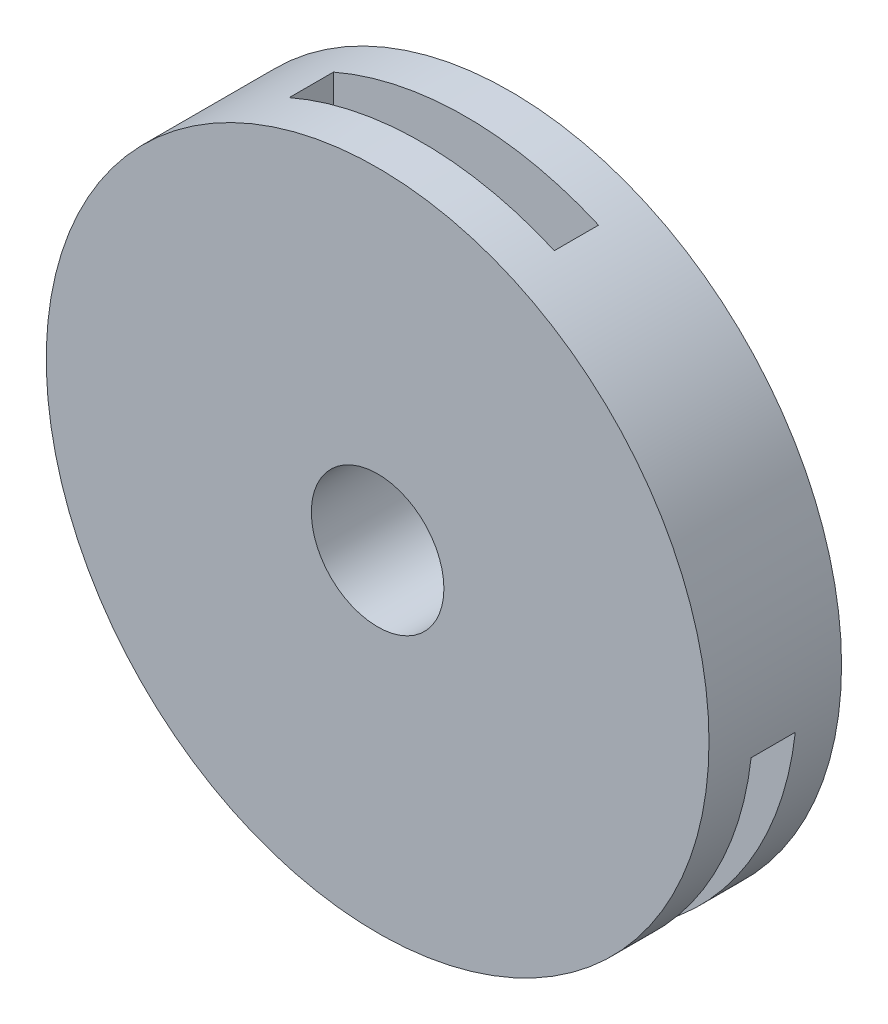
SolidWorks part; units mm, degrees
ref_plane "Alzado" through (0, 0, 0) normal (0, 0, 1) x (1, 0, 0)
ref_plane "Planta" through (0, 0, 0) normal (0, 1, 0) x (1, 0, 0)
ref_plane "Vista lateral" through (0, 0, 0) normal (1, 0, 0) x (0, 0, -1)
sketch "Croquis1" plane through (0, 0, 0) normal (0, 0, 1) x (1, 0, 0)
  circle A0 centre (0, 0) radius 75
  dimension "D1" = 150
extrude "Saliente-Extruir1" add sketch "Croquis1" along normal blind 30
ref_plane "Plano1" through (0, 40, 0) normal (0, 1, 0) x (-1, 0, 0)
sketch "Croquis5" plane through (0, 40, 0) normal (0, 1, 0) x (-1, 0, 0)
  line L1 (0, 10) -> (30, 10)
  line L2 (30, 10) -> (30, 20)
  line L3 (30, 20) -> (-30, 20)
  line L4 (-30, 20) -> (-30, 10)
  line L5 (-30, 10) -> (0, 10)
  dimension "D1" = 10
  dimension "D2" = 60
  dimension "D3" = 30
  dimension "D4" = 10
extrude "Cortar-Extruir2" cut sketch "Croquis5" along normal up to next
pattern_circular "MatrizC2" count 3 over 360 about axis through (0, 0, 0) along (0, 0, 1) of "Cortar-Extruir2"
sketch "Croquis9" plane through (0, 0, 30) normal (0, 0, 1) x (1, 0, 0)
  circle A0 centre (0, 0) radius 15
  dimension "D1" = 30
extrude "Cortar-Extruir4" cut sketch "Croquis9" against normal blind 30
